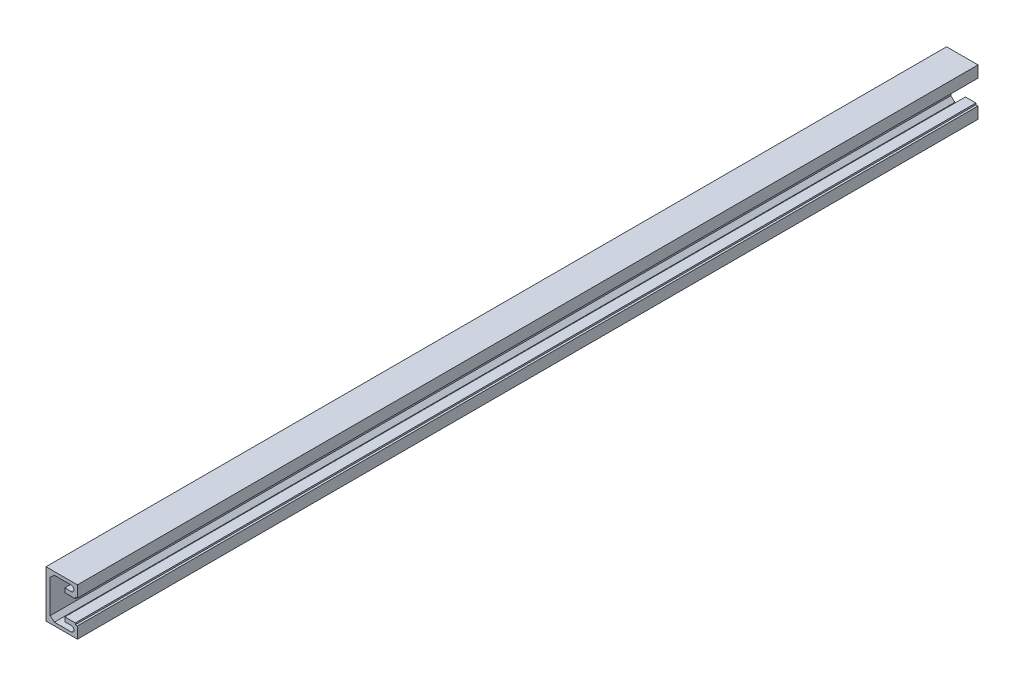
SolidWorks part; units mm, degrees
ref_plane "Front Plane" through (0, 0, 0) normal (0, 0, 1) x (1, 0, 0)
ref_plane "Top Plane" through (0, 0, 0) normal (0, 1, 0) x (1, 0, 0)
ref_plane "Right Plane" through (0, 0, 0) normal (1, 0, 0) x (0, 0, -1)
sketch "Sketch1" plane through (0, 0, 0) normal (0, 0, 1) x (1, 0, 0)
  line L0 (0, 11.25) -> (0, -11.25)
  line L1 (0, -11.25) -> (15, -11.25)
  line L2 (15, -11.25) -> (15, -5.75)
  line L3 (15, -5.75) -> (14, -5.75)
  line L4 (14, -5.75) -> (14, -5)
  line L5 (14, -5) -> (9, -5)
  line L6 (9, -5) -> (9, -7.0047)
  line L7 (9, -7.0047) -> (12, -7.0047)
  line L8 (12, -9.6934) -> (4, -9.6934)
  line L9 (2, -8) -> (2, 8)
  line L11 (2, -8) -> (4, -9.6934)
  line L12 (55, 0) -> (-55, 0) construction
  line L13 (0, 11.25) -> (15, 11.25)
  line L14 (15, 11.25) -> (15, 5.75)
  line L15 (15, 5.75) -> (14, 5.75)
  line L16 (14, 5.75) -> (14, 5)
  line L17 (14, 5) -> (9, 5)
  line L18 (9, 5) -> (9, 7.0047)
  line L19 (9, 7.0047) -> (12, 7.0047)
  line L20 (12, 9.6934) -> (4, 9.6934)
  line L21 (2, 8) -> (4, 9.6934)
  arc A0 (12, -7.0047) -> (12, -9.6934) centre (12, -8.3491) cw
  arc A1 (12, 7.0047) -> (12, 9.6934) centre (12, 8.3491) ccw
  dimension "D2" = 15
  dimension "D3" = 13
  dimension "D5" = 6
  dimension "D6" = 5
  dimension "D7" = 5.5
  dimension "D8" = 3
  dimension "D9" = 8
extrude "Boss-Extrude1" add sketch "Sketch1" along normal blind 430
